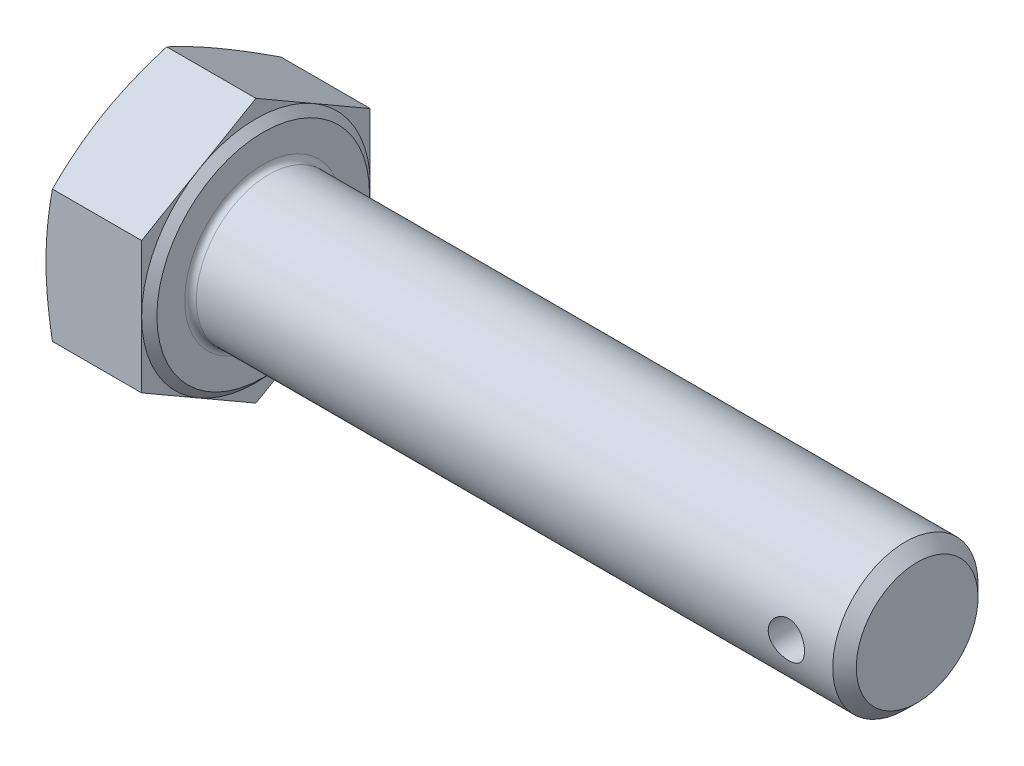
SolidWorks part; units mm, degrees
ref_plane "Front" through (0, 0, 0) normal (0, 0, 1) x (1, 0, 0)
ref_plane "Top" through (0, 0, 0) normal (0, 1, 0) x (1, 0, 0)
ref_plane "Right" through (0, 0, 0) normal (1, 0, 0) x (0, 0, -1)
sketch "Sketch-BaseHead" plane through (0, 0, 0) normal (1, 0, 0) x (0, 0, -1)
  line L1 (0, -9.0817) -> (7.865, -4.5409)
  line L2 (7.865, -4.5409) -> (7.865, 4.5409)
  line L3 (7.865, 4.5409) -> (0, 9.0817)
  line L4 (0, 9.0817) -> (-7.865, 4.5409)
  line L5 (-7.865, 4.5409) -> (-7.865, -4.5409)
  line L6 (-7.865, -4.5409) -> (0, -9.0817)
  circle A0 centre (0, 0) radius 7.865 construction
  dimension "s" = 15.73
extrude "BaseHead" add sketch "Sketch-BaseHead" along normal blind 6.58
sketch "Sketch4" plane through (-0.2646, -5.9169, 0) normal (0, 0, 1) x (0, 1, 0)
  line L0 (5.9169, 3.7369) -> (5.9169, -10.4477) construction
  line L2 (14.9986, -0.2646) -> (13.7819, -0.2646)
  line L4 (13.7819, -0.2646) -> (14.9986, -0.7075)
  line L6 (14.9986, -0.7075) -> (14.9986, -0.2646)
  dimension "D1" = 20
  dimension "D2" = 15.73
revolve "HeadChamfer" cut sketch "Sketch4" angle 360 about L0
sketch "Sketch1" plane through (0, 0, 0) normal (0, 1, 0) x (1, 0, 0)
  line L0 (6.58, 0) -> (7.08, 0)
  line L1 (7.08, 0) -> (7.08, 7.315)
  line L2 (7.08, 7.315) -> (6.58, 7.865)
  line L3 (6.58, 7.865) -> (6.58, 0)
  line L6 (-4.0016, 0) -> (10.1831, 0) construction
  dimension "D1" = 7.865
  dimension "D2" = 7.315
  dimension "D3" = 0.5
revolve "Revolve1" add sketch "Sketch1" angle 360 about axis through (-4.0016, 0, 0) along (1, 0, 0)
ref_plane "Plane2" through (26.08, 0, 0) normal (1, 0, 0) x (0, 0, -1)
sketch "Sketch3" plane through (7.08, 0, 0) normal (1, 0, 0) x (0, 0, -1)
  circle A0 centre (0, 0) radius 5
  dimension "d" = 10
extrude "BaseBody" add sketch "Sketch3" along normal blind 45
chamfer "Chamfer1" distance 0.812 angle 45 1 edges at (52.08, 5, 0)
fillet "HeadFillet" radius 0.4 1 edges at (7.08, -5, 0)
sketch "Sketch5" plane through (0, 0, 0) normal (0, 0, 1) x (1, 0, 0)
  line L2 (7.08, -7.315) -> (7.08, 7.315) construction
  line L3 (51.268, 0) -> (7.48, 0) construction
  circle A0 centre (48.08, 0) radius 1.25
  dimension "d1" = 2.5
  dimension "lh" = 41
extrude "Hole" cut sketch "Sketch5" against normal through all and the other way through all
equation "\"D1@Sketch1\" = \"s@Sketch-BaseHead\" / 2"
equation "\"D2@Sketch4\" = \"s@Sketch-BaseHead\""
equation "\"D1@Chamfer1\" = (  \"d@Sketch3\"  -\"D2@ThreadCosmetic1\" ) / 2 "
equation "\"b@ThreadCosmetic1\" = \"l@BaseBody\" - \"lg@Plane2\""
